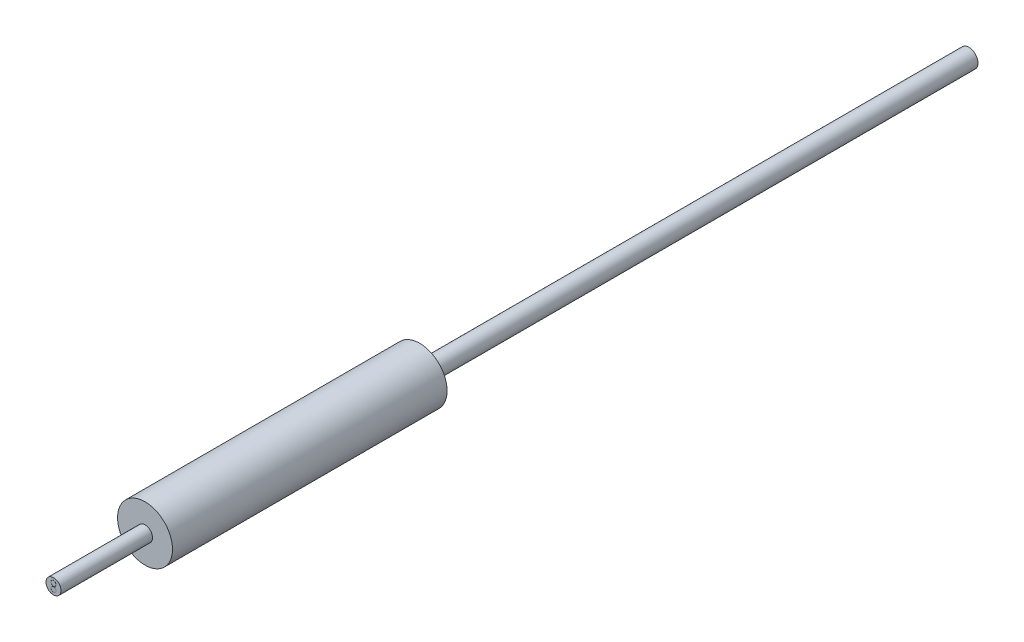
SolidWorks part; units mm, degrees
ref_plane "前视基准面" through (0, 0, 0) normal (0, 0, 1) x (1, 0, 0)
ref_plane "上视基准面" through (0, 0, 0) normal (0, 1, 0) x (1, 0, 0)
ref_plane "右视基准面" through (0, 0, 0) normal (1, 0, 0) x (0, 0, -1)
sketch "草图1" plane through (0, 0, 0) normal (0, 0, 1) x (1, 0, 0)
  circle A0 centre (0, 0) radius 1.5
  dimension "D1" = 3
extrude "凸台-拉伸1" add sketch "草图1" against normal blind 15
sketch "草图9" plane through (0, 0, -15) normal (0, 0, -1) x (-1, 0, 0)
  circle A0 centre (0, 0) radius 0.5
  dimension "D1" = 1
extrude "凸台-拉伸2" add sketch "草图9" along normal blind 30
sketch "草图10" plane through (0, 0, 0) normal (0, 0, 1) x (1, 0, 0)
  circle A0 centre (0, 0) radius 0.41
  dimension "D1" = 0.82
extrude "凸台-拉伸3" add sketch "草图10" along normal blind 5
sketch "草图11" plane through (0, 0, 5) normal (0, 0, 1) x (1, 0, 0)
  circle A0 centre (0, 0.1475) radius 0.1325
  circle A1 centre (0, -0.1475) radius 0.1325
  circle A2 centre (0, 0.1475) radius 0.1375
  circle A3 centre (0, -0.1475) radius 0.1375
  dimension "D1" = 0.265
  dimension "D2" = 0.275
  dimension "D3" = 0.01
  dimension "D4" = 0.01
extrude "切除-拉伸1" cut sketch "草图11" against normal blind 0.1
